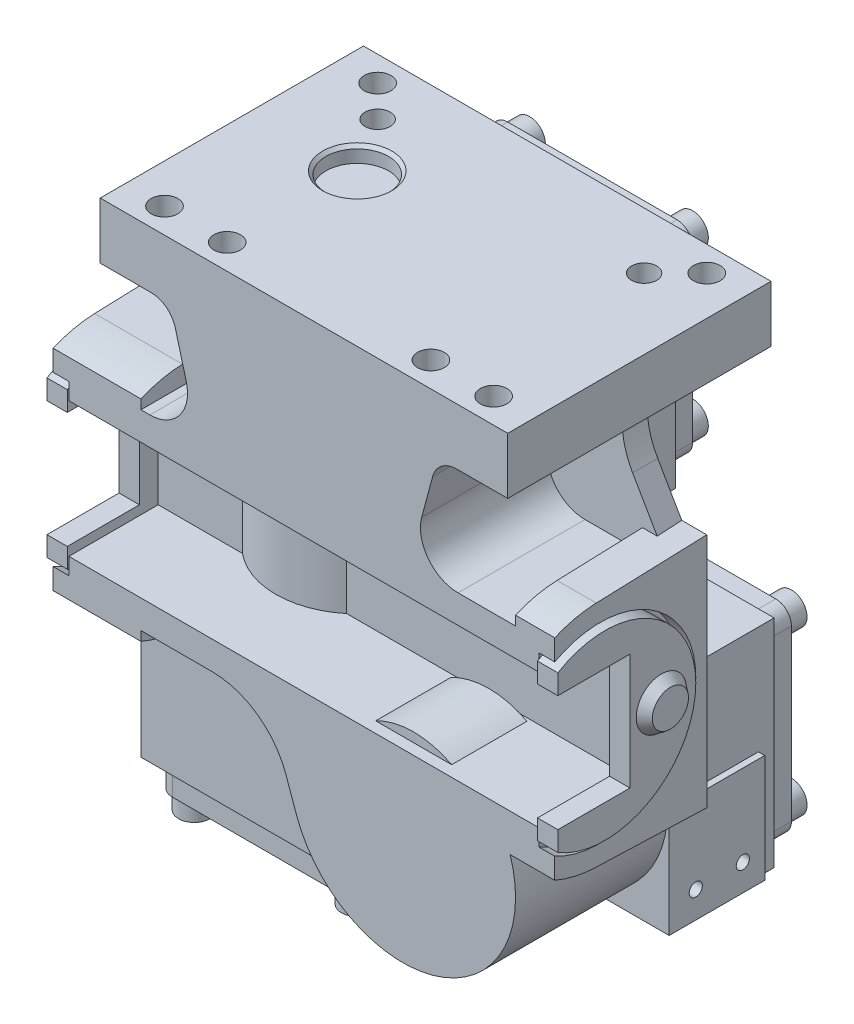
SolidWorks part; units mm, degrees
other "Detailelement1" parameters "D6"=21.1286, "D11"=12.0237, "D13"=58.5533, "D20"=12.7597, "D22"=117.4381, "Durchm_Senkung_Flansch__"=40, "D26"=74.2389, "D28"=10, "D15"=12.6748, "kopfduchm_zylsch_rolhaldeckel__"=10, "radius_rolhaldeckel__"=5, "D1"=72, "flanschbreite__"=84, "D2"=180, "D3"=63.247, "D4"=111.1593, "D5"=100.7124, "lochabstand_rolhaldeckel__"=52, "D7"=126.9513, "lochabstand_laengs_klein__"=20, "D8"=99.1768, "lochabstand_laengs_gross__"=65, "D9"=34.9237, "lochabstand_laengs_klein_2__"=20, "D10"=150, "lochabstand_breite__"=68, "D12"=55.5444, "D14"=57.5, "D16"=57.5, "D17"=52.75, "D18"=52.75, "D19"=52.75, "D21"=1.6078, "D23"=180, "laufposition_rolle_ort_AK_Schiene__"=7, "D24"=180, "Abstand_ort_rolle_bis_rolhaldeckel__"=68.5, "D25"=100.1259, "schienenbreite__"=29, "D27"=34.6, "flanschbreite_rolhaldeckel_lat_rolle__"=68, "breite_rippe_zwischen_ort_rollen__"=20, "breite_bearbeitete_flaeche_links__"=30.5, "dicke_rolhaldeckel__"=8, "kopfhoehe_zylsch_rolhaldeckel__"=6, "rollenbreite__"=24, "position_bearbeitete_flaeche_links__"=68, "rippenbreite__"=8
other "Detailelement2"
other "Detailelement3"
other "Detailelement4"
other "Detailelement5"
other "Detailelement6"
ref_plane "Ebene vorne" through (0, 0, 0) normal (0, 0, 1) x (1, 0, 0)
ref_plane "Ebene oben" through (0, 0, 0) normal (0, 1, 0) x (1, 0, 0)
ref_plane "Ebene rechts" through (0, 0, 0) normal (1, 0, 0) x (0, 0, -1)
sketch "Kontur_Aussenseite" plane through (0, 0, 0) normal (0, 0, 1) x (1, 0, 0)
  line L0 (-300, 0) -> (300, 0) construction
  line L1 (-300, 18.5) -> (300, 18.5) construction
  line L2 (-300, 18.5) -> (-300, -18.5) construction
  line L3 (-300, -18.5) -> (300, -18.5) construction
  line L4 (300, 18.5) -> (300, -18.5) construction
  line L5 (0, 0) -> (0, 44.5) construction
  line L6 (-34.5, 64.5) -> (-34.5, 49.5436)
  line L7 (-3, -79) -> (66, -79)
  line L8 (-3, -79) -> (-3, -49.5436)
  line L9 (-3, -10) -> (66, -10)
  line L10 (66, -79) -> (66, -10)
  line L11 (-3, -79) -> (66, -10) construction
  line L12 (-3, -10) -> (66, -79) construction
  line L13 (-34.5, 10) -> (34.5, 10)
  line L14 (34.5, 10) -> (34.5, 64.5)
  line L15 (34.5, 64.5) -> (65, 64.5)
  line L16 (65, 64.5) -> (65, 82.5)
  line L17 (65, 82.5) -> (-65, 82.5)
  line L18 (-65, 82.5) -> (-65, 64.5)
  line L19 (-65, 64.5) -> (-34.5, 64.5)
  line L20 (0, 44.5) -> (0, 82.5) construction
  line L21 (0, 44.5) -> (-31.25, 44.5) construction
  line L22 (31.5, -44.5) -> (0.25, -44.5) construction
  line L23 (-34.5, 39.4564) -> (-34.5, 10)
  line L24 (-3, -39.4564) -> (-3, -10)
  line L28 (-31.5, -83.9179) -> (-31.5, 0) construction
  line L29 (-66.5, -40) -> (4.5, -40)
  line L30 (-66.5, -40) -> (-66.5, -80)
  line L31 (-66.5, -80) -> (4.5, -80)
  line L32 (4.5, -40) -> (4.5, -80)
  line L33 (-57.5, -11.5) -> (-5.5, -11.5) construction
  line L34 (-57.5, 0.5) -> (-5.5, 0.5) construction
  line L35 (-57.5, 0.5) -> (-57.5, -23.5) construction
  line L36 (-57.5, -23.5) -> (-5.5, -23.5) construction
  line L37 (-5.5, 0.5) -> (-5.5, -23.5) construction
  line L41 (-65.5, -40) -> (-65.5, 18)
  line L42 (-65.5, 18) -> (2.5, 18)
  line L43 (2.5, 18) -> (2.5, -40)
  line L50 (-31.5, 0) -> (-31.5, 74) construction
  line L53 (26, 18.5) -> (34.5, 10) construction
  line L54 (-26, 18.5) -> (26, 18.5) construction
  line L55 (-26, 18.5) -> (-26, 70.5) construction
  line L56 (-26, 70.5) -> (26, 70.5) construction
  line L57 (26, 18.5) -> (26, 70.5) construction
  line L58 (-26, 18.5) -> (26, 70.5) construction
  line L59 (-26, 70.5) -> (26, 18.5) construction
  line L60 (5.5, -18.5) -> (57.5, -18.5) construction
  line L61 (5.5, -18.5) -> (5.5, -70.5) construction
  line L62 (5.5, -70.5) -> (57.5, -70.5) construction
  line L63 (57.5, -18.5) -> (57.5, -70.5) construction
  line L68 (-63.5, -80) -> (-63.5, -88)
  line L69 (-63.5, -88) -> (0.5, -88)
  line L74 (0.5, -88) -> (0.5, -80)
  line L75 (-62.5, -88) -> (-62.5, -94)
  line L76 (-62.5, -94) -> (-52.5, -94)
  line L77 (-52.5, -94) -> (-52.5, -88)
  line L78 (-10.5, -88) -> (-10.5, -94)
  line L79 (-10.5, -94) -> (-0.5, -94)
  line L80 (-0.5, -94) -> (-0.5, -88)
  line L81 (-57.5, -94) -> (-57.5, -88) construction
  line L82 (-5.5, -94) -> (-5.5, -88) construction
  line L83 (-57.5, -91) -> (-5.5, -91) construction
  line L85 (-27, 76.5) -> (27, 76.5)
  line L86 (-32, 71.5) -> (-32, 17.5)
  line L87 (-27, 12.5) -> (27, 12.5)
  line L88 (32, 71.5) -> (32, 17.5)
  line L89 (4.5, -12.5) -> (58.5, -12.5)
  line L90 (-0.5, -17.5) -> (-0.5, -71.5)
  line L91 (4.5, -76.5) -> (58.5, -76.5)
  line L92 (63.5, -17.5) -> (63.5, -71.5)
  circle A0 centre (0, 44.5) radius 26 construction
  circle A1 centre (31.5, -44.5) radius 26 construction
  arc A2 (-34.5, 49.5436) -> (-34.5, 39.4564) centre (-31.25, 44.5) ccw
  arc A3 (-3, -39.4564) -> (-3, -49.5436) centre (0.25, -44.5) ccw
  circle A4 centre (26, 70.5) radius 5
  circle A5 centre (-26, 70.5) radius 5
  circle A6 centre (-26, 18.5) radius 5
  circle A7 centre (26, 18.5) radius 5
  circle A8 centre (57.5, -18.5) radius 5
  circle A9 centre (5.5, -18.5) radius 5
  circle A10 centre (57.5, -70.5) radius 5
  circle A11 centre (5.5, -70.5) radius 5
  arc A12 (-27, 76.5) -> (-32, 71.5) centre (-27, 71.5) ccw
  arc A13 (27, 76.5) -> (32, 71.5) centre (27, 71.5) cw
  arc A14 (27, 12.5) -> (32, 17.5) centre (27, 17.5) ccw
  arc A15 (-32, 17.5) -> (-27, 12.5) centre (-27, 17.5) ccw
  arc A16 (4.5, -12.5) -> (-0.5, -17.5) centre (4.5, -17.5) ccw
  arc A17 (58.5, -12.5) -> (63.5, -17.5) centre (58.5, -17.5) cw
  arc A18 (58.5, -76.5) -> (63.5, -71.5) centre (58.5, -71.5) ccw
  arc A19 (-0.5, -71.5) -> (4.5, -76.5) centre (4.5, -71.5) ccw
  point P6 (0, 0)
  point P19 (0, 10)
  point P26 (0, 44.5)
  point P28 (31.5, -44.5)
  point P29 (-31.25, 44.5)
  point P30 (0.25, -44.5)
  point P52 (-31.5, -11.5)
  point P57 (-31.5, 0)
  point P68 (-31.5, -88)
  point P69 (0, 18.5)
  point P71 (31.5, -18.5)
  point P80 (5.5, -18.5)
  point P81 (57.5, -18.5)
  point P82 (57.5, -70.5)
  point P83 (5.5, -70.5)
  point P84 (-26, 70.5)
  point P85 (26, 70.5)
  point P86 (26, 18.5)
  point P87 (-26, 18.5)
  point P103 (-31.5, -91)
  point P104 (4.5, -80)
  point P105 (-66.5, -80)
  point P130 (57.5, -44.5)
  dimension "Rollendurchmesser_ort__" = 52
  dimension "Durchm_Gussausbuchtung_Sicherungsschraube__" = 12
  dimension "Zylsch_kopfdurchmesser_rolhaldeckel__" = 10
  dimension "Radius_rolhaldeckel__" = 5
  dimension "Schienenhoehe__" = 37
  dimension "D2" = 600
  dimension "Abstand_Ursprung_bis_ort_Rolle__" = 31.5
  dimension "flanschbreite_rolhaldeckel_ort_rolle__" = 69
  dimension "abstand_flansch_obereRolle__" = 38
  dimension "flanschdicke__" = 18
  dimension "l_flansch__" = 130
  dimension "Abstand_Sicherungsschraube_Exzenter__" = 31.25
  dimension "Abstand_Ursprung_bis_lat_Rolle__" = 31.5
  dimension "Rollendurchmesser_lat__" = 52
  dimension "Rollenbreite__" = 24
  dimension "Laufposition_lat_Rolle_UKSchiene__" = 7
  dimension "Abstand_lat_Rolle_rolhaldeckel__" = 68.5
  dimension "flanschdicke_lat_rolle__" = 40
  dimension "durchm_guss_lat_rolle__" = 68
  dimension "l_Gusszylinder_lat_Rolle__" = 98
  dimension "Lochabstand_rolhaldeckel__" = 52
  dimension "zentrum_lat_rolle_bis_flaeche_mitte__" = 36
  dimension "zentrum_lat_rolle_bis_flaeche_aussen__" = 35
  dimension "l_rolhaldeckel_lat__" = 64
  dimension "dicke_rolhaldeckel__" = 8
  dimension "kopfhoehe_zylsch_rolhaldeckel__" = 6
  dimension "zylschkopfduchrm_rolhaldeckel__" = 10
  dimension "l_rolhaldeckel__" = 64
sketch "Kontur_Innenseite" plane through (0, 0, 0) normal (0, 0, 1) x (1, 0, 0)
  line L0 (-300, -18.5) -> (300, -18.5) construction
  line L1 (-300, 18.5) -> (300, 18.5) construction
  line L2 (-300, -18.5) -> (300, -18.5) construction
  line L3 (-300, 18.5) -> (300, 18.5) construction
  line L4 (65, 64.5) -> (65, 82.5) construction
  line L5 (-65, 82.5) -> (-65, 64.5) construction
  line L6 (65, 82.5) -> (-65, 82.5) construction
  line L7 (65, 64.5) -> (65, 82.5)
  line L8 (-65, 82.5) -> (-65, 64.5)
  line L9 (65, 82.5) -> (-65, 82.5)
  line L10 (34.5, 64.5) -> (65, 64.5) construction
  line L11 (-65, 64.5) -> (-34.5, 64.5) construction
  line L12 (40, 64.5) -> (65, 64.5)
  line L13 (-65, 64.5) -> (-40, 64.5)
  line L16 (-300, 18.5) -> (-300, -18.5) construction
  line L17 (300, 18.5) -> (300, -18.5) construction
  line L18 (300, 0) -> (-300, 0) construction
  line L19 (67.5, 30.5) -> (67.5, 50)
  line L22 (24.7389, 82.5) -> (80.1583, -74.0818) construction
  line L23 (67.5, 30.5) -> (51.4563, 30.5)
  line L28 (-52, -30.5) -> (-29.3147, -30.5)
  line L29 (-5.7473, -47.1587) -> (-33.9371, 32.4886) construction
  line L30 (-5.7473, -47.1587) -> (-2.4371, -56.5114)
  line L40 (-61, 64.5) -> (-61, 63.5)
  line L41 (-64.3494, 51) -> (-64.9267, 50)
  line L42 (0, 82.5) -> (0, 0) construction
  line L44 (61, 64.5) -> (61, 63.5)
  line L45 (67.5, -30.5) -> (67.5, -50) construction
  line L46 (67.5, -50) -> (67.0774, -50) construction
  line L51 (-52, 30.5) -> (-52, -30.5) construction
  line L59 (67.5, 30.5) -> (67.5, -30.5) construction
  line L60 (-52, 30.5) -> (-76.185, 30.5) construction
  line L66 (-64.9267, 50) -> (-76.185, 30.5) construction
  line L68 (-80, -50) -> (-52, -50)
  line L69 (-52, -50) -> (-52, -30.5)
  line L70 (-52, 30.5) -> (-52, 50)
  line L71 (-52, 50) -> (-80, 50)
  line L72 (-80, 50) -> (-80, -50)
  line L74 (64.3494, 51) -> (67.5, 45.5429)
  line L75 (67.5, 50) -> (80, 50)
  line L77 (80, -50) -> (67.0774, -50)
  line L79 (80, 50) -> (80, -50)
  line L83 (-36, 59.98) -> (-36, 60.5)
  line L84 (-52, 30.5) -> (-51.4563, 30.5)
  line L86 (51.4563, 30.5) -> (67.5, 30.5)
  line L87 (-36, 52.4356) -> (-36, 44.5) construction
  line L88 (36, 60.5) -> (36, 59.98)
  line L89 (-36, 52.4356) -> (-36, 59.98) construction
  line L90 (36, 59.98) -> (36, 44.5) construction
  line L91 (67.5, 45.5429) -> (76.185, 30.5) construction
  line L92 (76.185, 30.5) -> (67.5, 30.5) construction
  circle A0 centre (31.5, -44.5) radius 26 construction
  circle A1 centre (0, 44.5) radius 26 construction
  circle A2 centre (31.5, -44.5) radius 26 construction
  circle A3 centre (0, 44.5) radius 26 construction
  arc A5 (-2.4371, -56.5114) -> (67.0774, -50) centre (31.5, -44.5) ccw
  arc A7 (36, 44.5) -> (-36, 44.5) centre (0, 44.5) cw construction
  arc A15 (-29.3147, -30.5) -> (-5.7473, -47.1587) centre (-29.3147, -55.5) cw
  arc A18 (51.4563, 30.5) -> (39.5818, 40.7692) centre (51.4563, 42.5) cw
  arc A20 (-61, 63.5) -> (-64.3494, 51) centre (-86, 63.5) cw
  arc A21 (61, 63.5) -> (64.3494, 51) centre (86, 63.5) ccw
  arc A24 (-40, 64.5) -> (-36, 60.5) centre (-40, 60.5) cw
  arc A30 (-51.4563, 30.5) -> (-39.5818, 40.7692) centre (-51.4563, 42.5) ccw
  arc A31 (-39.5818, 40.7692) -> (-38, 47.49) centre (0, 35) cw
  arc A32 (39.5818, 40.7692) -> (51.4563, 30.5) centre (51.4563, 42.5) ccw
  arc A33 (-38, 47.49) -> (-36, 59.98) centre (-76, 59.98) ccw
  arc A36 (36, 60.5) -> (40, 64.5) centre (40, 60.5) cw
  arc A39 (38, 47.49) -> (36, 59.98) centre (76, 59.98) cw
  arc A40 (39.5818, 40.7692) -> (38, 47.49) centre (0, 35) ccw
  point P7 (-80, 0)
  point P21 (-76.185, 30.5)
  point P51 (-52, 0)
  point P103 (-67.5, 25)
  dimension "Radius_unten__" = 25
  dimension "D9" = 100
  dimension "Radius_an_rippe__" = 25
  dimension "erster_Radius_oben__" = 4
  dimension "Gussradius_ort_rollen__" = 36
  dimension "zweiter_Radius_oben__" = 40
  dimension "dritter_Radius_oben__" = 40
  dimension "vierter_Radius_oben__" = 12
  dimension "offset_Rippe__" = 4
  dimension "lanege_gerades_stueck_rippe__" = 1
  dimension "winkel_rippe__" = 30
  dimension "hor_position_schmiergewinde__" = 12.5
  dimension "ver_position_schmiergewinde__" = 25
  dimension "Zentrum_bis_linkes_ende__" = 80
  dimension "Zentrum_bis_rechtes_ende__" = 80
  dimension "zentrum_dritter_radius__" = 35
  dimension "Gussbahnbreite_aussen__" = 61
  dimension "abstreiferflanschbreite_links__" = 28
  dimension "abstreiferflanschbreite_rechts__" = 12.5
sketch "Grundriss" plane through (0, 0, 0) normal (0, 1, 0) x (1, 0, 0)
  line L1 (65, -42) -> (-65, -42)
  line L2 (65, -42) -> (65, 42)
  line L3 (65, 42) -> (-65, 42)
  line L4 (-65, -42) -> (-65, 42)
  line L5 (65, -42) -> (-65, 42) construction
  line L6 (65, 42) -> (-65, -42) construction
  line L8 (-66.5, 40.5) -> (-66.5, -27.5)
  line L9 (-57.5, 6.5) -> (-66.5, 6.5) construction
  line L10 (-65.5, 0) -> (-65.5, 6.5) construction
  line L11 (-300, 0) -> (300, 0) construction
  line L12 (0, 6.5) -> (0, 0) construction
  line L19 (4.5, 40.5) -> (4.5, -27.5)
  line L20 (-5.5, -19.5) -> (-57.5, -19.5) construction
  line L21 (-5.5, -19.5) -> (-5.5, 32.5) construction
  line L22 (-5.5, 32.5) -> (-57.5, 32.5) construction
  line L23 (-57.5, -19.5) -> (-57.5, 32.5) construction
  line L25 (-5.5, 32.5) -> (-57.5, -19.5) construction
  line L26 (-31.5, 6.5) -> (-57.5, 6.5) construction
  line L27 (-31.5, 26.5) -> (34.5, 26.5)
  line L28 (-31.5, 6.5) -> (-31.5, 32.5) construction
  line L31 (0, 0) -> (52.5, 0) construction
  line L32 (-52.5, 34) -> (52.5, 34) construction
  line L33 (-52.5, 34) -> (-52.5, -34) construction
  line L34 (-52.5, -34) -> (52.5, -34) construction
  line L35 (52.5, 34) -> (52.5, -34) construction
  line L36 (0, 34) -> (0, 0) construction
  line L37 (34.5, 26.5) -> (34.5, 0)
  line L38 (5.5, 0) -> (57.5, 0) construction
  line L39 (65, 37) -> (68, 37)
  line L40 (68, 37) -> (68, 0)
  line L41 (-3, 0) -> (66, 0) construction
  line L42 (65, 42) -> (63.5, 42) construction
  line L47 (-300, -26.5) -> (300, -26.5) construction
  line L48 (-300, -19.5) -> (300, -19.5) construction
  line L49 (-300, -19.5) -> (-300, -48.5) construction
  line L50 (-300, -48.5) -> (300, -48.5) construction
  line L51 (300, -19.5) -> (300, -48.5) construction
  line L52 (-57.5, 0) -> (-57.5, 6.5) construction
  line L53 (-31.5, 0) -> (-31.5, 6.5) construction
  line L55 (-66.5, 40.5) -> (4.5, 40.5)
  line L58 (4.5, -27.5) -> (-66.5, -27.5)
  line L59 (63.5, 42) -> (63.5, 50)
  line L61 (63.5, 50) -> (-0.5, 50)
  line L62 (-0.5, 50) -> (-0.5, 42)
  line L63 (0.5, 50) -> (0.5, 56)
  line L64 (0.5, 56) -> (10.5, 56)
  line L66 (10.5, 56) -> (10.5, 50)
  line L67 (-10.5, 0) -> (-0.5, 0) construction
  line L68 (5.5, 56) -> (5.5, 50) construction
  line L69 (31.5, 50) -> (31.5, -26.5) construction
  line L70 (-58.5, 38.5) -> (-4.5, 38.5)
  line L71 (-63.5, 33.5) -> (-63.5, -20.5)
  line L72 (-58.5, -25.5) -> (-4.5, -25.5)
  line L73 (0.5, 33.5) -> (0.5, -20.5)
  line L74 (-63.5, 6.5) -> (-76.185, 6.5) construction
  line L75 (5.5, -38.5) -> (57.5, -38.5) construction
  line L76 (5.5, -38.5) -> (5.5, -14.5) construction
  line L77 (5.5, -14.5) -> (57.5, -14.5) construction
  line L78 (57.5, -38.5) -> (57.5, -14.5) construction
  line L79 (5.5, -38.5) -> (57.5, -14.5) construction
  line L80 (5.5, -14.5) -> (57.5, -38.5) construction
  line L81 (-76.185, 6.5) -> (-76.185, -1.5) construction
  line L82 (-76.185, -1.5) -> (-65, -1.5) construction
  circle A2 centre (-31.5, 6.5) radius 34
  circle A10 centre (-57.5, 32.5) radius 5
  circle A14 centre (-57.5, -19.5) radius 5
  circle A22 centre (-31.5, 6.5) radius 26 construction
  circle A25 centre (-5.5, 32.5) radius 5
  circle A26 centre (-5.5, -19.5) radius 5
  arc A27 (-58.5, 38.5) -> (-63.5, 33.5) centre (-58.5, 33.5) ccw
  arc A28 (-4.5, 38.5) -> (0.5, 33.5) centre (-4.5, 33.5) cw
  arc A29 (-4.5, -25.5) -> (0.5, -20.5) centre (-4.5, -20.5) ccw
  arc A30 (-63.5, -20.5) -> (-58.5, -25.5) centre (-58.5, -20.5) ccw
  circle A31 centre (-31.5, 6.5) radius 10 construction
  point P0 (0, 0)
  point P7 (0, -48.5)
  point P8 (0, 6.5)
  point P22 (0, -19.5)
  point P29 (34.5, 0)
  point P30 (0, 42)
  point P33 (0, -42)
  point P38 (-57.5, 32.5)
  point P39 (-5.5, 32.5)
  point P40 (-5.5, -19.5)
  point P41 (-57.5, -19.5)
  point P59 (32.5, -34)
  point P60 (-32.5, -34)
  point P61 (-52.5, -34)
  point P62 (52.5, -34)
  point P63 (52.5, 34)
  point P64 (-52.5, 34)
  point P108 (-63.5, 6.5)
sketch "Seitenriss" plane through (0, 0, 0) normal (1, 0, 0) x (0, 0, -1)
  line L0 (0, 0) -> (-48.5, 0) construction
  line L1 (34, 0) -> (-34, 0) construction
  line L2 (-48.5, 18.5) -> (-19.5, 18.5) construction
  line L3 (-48.5, 18.5) -> (-48.5, -18.5) construction
  line L4 (-48.5, -18.5) -> (-19.5, -18.5) construction
  line L5 (-19.5, 18.5) -> (-19.5, -18.5) construction
  line L6 (6.5, -79) -> (37, -79)
  line L7 (15, -70.5) -> (30, -70.5) construction
  line L9 (-42.5, 26.5565) -> (-42.5, 18.5)
  line L10 (37, -79) -> (37, -44.5)
  line L12 (37, -44.5) -> (6.5, -44.5)
  line L13 (6.5, -44.5) -> (6.5, -79)
  line L26 (-42.5, -18.5) -> (-42.5, -26.5565)
  line L39 (-42, 21.5) -> (-42, -21.5) construction
  line L40 (-42, 21.5) -> (-13.5, 21.5)
  line L41 (-13.5, 21.5) -> (-13.5, -21.5)
  line L42 (-13.5, -21.5) -> (-42, -21.5)
  line L44 (-42, 33.4963) -> (-42, 21.5)
  line L46 (-42, -33.4963) -> (-42, -21.5)
  line L48 (6.5, -37.7096) -> (-28.7738, -36.4778)
  line L49 (6.5, 37.7096) -> (-28.7738, 36.4778)
  line L52 (6.5, 37.7096) -> (6.5, -37.7096)
  line L56 (-15.7181, -41.6798) -> (-38.043, -34.9442) construction
  line L57 (-13.75, -42.0055) -> (6.5, -42.7126) construction
  line L58 (6.5, -37.7096) -> (6.5, -42.7126) construction
  line L59 (-38.5, 18.5) -> (-38.5, 70.5) construction
  line L60 (-38.5, 70.5) -> (-14.5, 70.5) construction
  line L61 (-14.5, 70.5) -> (-14.5, 18.5) construction
  line L62 (-14.5, 18.5) -> (-19.5, 18.5) construction
  line L63 (-26.5, 70.5) -> (-26.5, 18.5) construction
  line L64 (-38.5, 44.5) -> (-14.5, 44.5) construction
  line L65 (-38.5, -18.5) -> (-38.5, -70.5) construction
  line L66 (-38.5, -70.5) -> (-14.5, -70.5) construction
  line L67 (-14.5, -70.5) -> (-14.5, -18.5) construction
  line L68 (-14.5, -18.5) -> (-19.5, -18.5) construction
  line L69 (-38.5, -44.5) -> (-14.5, -44.5) construction
  line L70 (-26.5, -70.5) -> (-26.5, -18.5) construction
  arc A1 (-28.7738, 36.4778) -> (-42, 33.4963) centre (-27.5, 0) ccw
  arc A2 (-42.5, -26.5565) -> (-42.5, 26.5565) centre (-27.5, 0) ccw
  arc A3 (-42, -33.4963) -> (-28.7738, -36.4778) centre (-27.5, 0) ccw
  arc A4 (-13.75, -42.0055) -> (-15.7181, -41.6798) centre (-13.4795, -34.2602) cw construction
  arc A5 (-42.5, -24.8193) -> (-42.5, 24.8193) centre (-27.5, 0) ccw
  point P7 (-48.5, 0)
  point P16 (15, -70.5)
  point P17 (30, -70.5)
  point P50 (-42, 0)
  point P51 (-9.5, 0)
  dimension "Aussendurchm_Abstreiferflansch__" = 73
  dimension "durchm_abstreiferanfraesung__" = 61
  dimension "D1" = 15
  dimension "D5" = 7.75
  dimension "D6" = 1.5
  dimension "D3" = 20.25
  dimension "D4" = 5
  dimension "abstand_schiene_bis_Guss__" = 6
  dimension "D21" = 4
  dimension "D22" = 2
  dimension "Nuthoehe_Schiene__" = 43
  dimension "pos_befestigungsloch_abstreifer__" = 9.5
  dimension "pos_zentrum_abstreifer__" = 27.5
  dimension "hor_pos_gewinde_nulmar__" = 15
  dimension "hor_abstand_gewinde_nulmar__" = 15
  dimension "ver_pos_gewinde_nulmar__" = 70.5
ref_plane "Ebene4" through (0, 0, -6.5) normal (0, 0, 1) x (1, 0, 0)
sketch "Skizze4" plane through (0, 0, -6.5) normal (0, 0, 1) x (1, 0, 0)
  line L0 (-65, 64.5) -> (-34.5, 64.5) construction
  line L1 (-34.5, 64.5) -> (-34.5, 49.5436) construction
  line L2 (-34.5, 39.4564) -> (-34.5, 10) construction
  line L3 (-34.5, 10) -> (34.5, 10) construction
  line L4 (34.5, 10) -> (34.5, 64.5) construction
  line L5 (34.5, 64.5) -> (65, 64.5) construction
  line L6 (-65, 82.5) -> (-65, 64.5) construction
  line L8 (65, 64.5) -> (65, 82.5) construction
  line L11 (-65, 64.5) -> (-34.5, 64.5)
  line L12 (-34.5, 64.5) -> (-34.5, 49.5436)
  line L13 (-34.5, 39.4564) -> (-34.5, 10)
  line L14 (-34.5, 10) -> (34.5, 10)
  line L15 (34.5, 10) -> (34.5, 64.5)
  line L16 (34.5, 64.5) -> (65, 64.5)
  line L17 (-65, 82.5) -> (-65, 64.5)
  line L18 (65, 82.5) -> (-65, 82.5) construction
  line L19 (65, 64.5) -> (65, 82.5)
  line L20 (65, 82.5) -> (-65, 82.5)
  line L22 (66, -79) -> (66, -10) construction
  line L23 (-3, -79) -> (66, -79) construction
  line L24 (-3, -79) -> (-3, -49.5436) construction
  line L25 (-3, -39.4564) -> (-3, -10) construction
  line L26 (-3, -10) -> (66, -10) construction
  line L27 (66, -79) -> (66, -10)
  line L28 (-3, -79) -> (66, -79)
  line L29 (-3, -79) -> (-3, -49.5436)
  line L30 (-3, -39.4564) -> (-3, -10)
  line L31 (-3, -10) -> (66, -10)
  arc A0 (-34.5, 49.5436) -> (-34.5, 39.4564) centre (-31.25, 44.5) ccw construction
  arc A1 (-34.5, 49.5436) -> (-34.5, 39.4564) centre (-31.25, 44.5) ccw
  arc A2 (-3, -39.4564) -> (-3, -49.5436) centre (0.25, -44.5) ccw construction
  arc A3 (-3, -39.4564) -> (-3, -49.5436) centre (0.25, -44.5) ccw
extrude "Linear austragen1" add sketch "Skizze4" against normal up to vertex (35.5 mm away)
sketch "Skizze9" plane through (0, 0, -6.5) normal (0, 0, 1) x (1, 0, 0)
  line L0 (34.5, 10) -> (34.5, 64.5) construction
  line L1 (34.5, 10) -> (34.5, -10)
  line L2 (66, -10) -> (-3, -10) construction
  line L3 (34.5, -10) -> (-3, -10)
  line L4 (-34.5, 10) -> (34.5, 10) construction
  line L5 (-31.5, 10) -> (34.5, 10)
  line L6 (-3, -10) -> (-3, -39.4564) construction
  line L7 (-3, -10) -> (-3, -79)
  line L8 (-31.5, 10) -> (-31.5, -79)
  line L9 (-31.5, -79) -> (-3, -79)
  line L10 (-31.5, -83.9179) -> (-31.5, 0) construction
extrude "Linear austragen4" add sketch "Skizze9" against normal up to vertex (20 mm away)
sketch "Skizze7" [suppressed] plane through (0, 0, -1.25) normal (0, 0, 1) x (1, 0, 0)
  line L1 (90, 104.3) -> (90, 131.3) construction
  line L2 (69, 104.3) -> (90, 104.3) construction
  line L3 (90, 131.3) -> (-90, 131.3) construction
  line L4 (100, 37) -> (88.3375, 37) construction
  line L5 (-59, 86.815) -> (-59, 94.3) construction
  line L6 (-59, 86.815) -> (-59, 94.3)
  line L7 (-90.5, 37) -> (-88.3375, 37) construction
  line L8 (-90.5, 37) -> (-88.3375, 37)
  line L10 (-11.1537, -69.3613) -> (-3.7068, -89.1137) construction
  line L11 (-90.5, -37) -> (-57.9391, -37) construction
  line L12 (59, 94.3) -> (59, 86.815) construction
  line L13 (59, 94.3) -> (59, 86.815)
  line L14 (100, 37) -> (100, -37) construction
  line L15 (90, 131.3) -> (-90, 131.3)
  line L16 (-90, 104.3) -> (-69, 104.3) construction
  line L17 (-90, 131.3) -> (-90, 104.3) construction
  line L21 (90, 104.3) -> (90, 131.3)
  line L22 (69, 104.3) -> (90, 104.3)
  line L23 (100, 37) -> (100, -34.7031)
  line L24 (100, 37) -> (88.3375, 37)
  line L30 (-11.1537, -69.3613) -> (-3.7068, -89.1137)
  line L31 (-90.5, -37) -> (-57.9391, -37)
  line L36 (-90, 104.3) -> (-69, 104.3)
  line L37 (-90, 131.3) -> (-90, 104.3)
  line L41 (-90.5, 37) -> (-90.5, -37) construction
  line L42 (-90.5, 37) -> (-90.5, -37)
  arc A2 (72.0142, 49.2511) -> (88.3375, 37) centre (88.3375, 54) ccw construction
  arc A3 (-3.7068, -89.1137) -> (107.5902, -50) centre (51.5, -68.3) ccw construction
  arc A4 (-11.1537, -69.3613) -> (-57.9391, -37) centre (-57.9391, -87) ccw construction
  arc A8 (69, 104.3) -> (59, 94.3) centre (69, 94.3) ccw construction
  arc A9 (59, 86.815) -> (64.5652, 66.4619) centre (99, 86.815) ccw construction
  arc A10 (72.0142, 49.2511) -> (88.3375, 37) centre (88.3375, 54) ccw
  arc A11 (-3.7068, -89.1137) -> (100, -34.7031) centre (51.5, -68.3) ccw
  arc A12 (-11.1537, -69.3613) -> (-57.9391, -37) centre (-57.9391, -87) ccw
  arc A14 (-88.3375, 37) -> (-72.0142, 49.2511) centre (-88.3375, 54) ccw construction
  arc A16 (-59, 94.3) -> (-69, 104.3) centre (-69, 94.3) ccw construction
  arc A17 (-88.3375, 37) -> (-72.0142, 49.2511) centre (-88.3375, 54) ccw
  arc A18 (-59, 94.3) -> (-69, 104.3) centre (-69, 94.3) ccw
  arc A19 (-64.5652, 66.4619) -> (-59, 86.815) centre (-99, 86.815) ccw construction
  arc A20 (-64.5652, 66.4619) -> (-72.0142, 49.2511) centre (0, 28.3) ccw construction
  arc A21 (-64.5652, 66.4619) -> (-59, 86.815) centre (-99, 86.815) ccw
  arc A22 (-64.5652, 66.4619) -> (-72.0142, 49.2511) centre (0, 28.3) ccw
  arc A23 (72.0142, 49.2511) -> (64.5652, 66.4619) centre (0, 28.3) ccw construction
  arc A24 (69, 104.3) -> (59, 94.3) centre (69, 94.3) ccw
  arc A25 (59, 86.815) -> (64.5652, 66.4619) centre (99, 86.815) ccw
  arc A26 (72.0142, 49.2511) -> (64.5652, 66.4619) centre (0, 28.3) ccw
extrude "Kontur_Schienenseitig_RB72_90" [suppressed] add sketch "Skizze7" along normal up to vertex
sketch "Skizze91" plane through (0, 0, -6.5) normal (0, 0, 1) x (1, 0, 0)
  line L0 (65, 64.5) -> (65, 82.5) construction
  line L1 (-65, 82.5) -> (-65, 64.5) construction
  line L2 (65, 82.5) -> (-65, 82.5) construction
  line L3 (65, 64.5) -> (65, 82.5)
  line L4 (-65, 82.5) -> (-65, 64.5)
  line L5 (65, 82.5) -> (-65, 82.5)
  line L6 (-65, 64.5) -> (-34.5, 64.5) construction
  line L7 (-65, 64.5) -> (-48.7675, 64.5)
  line L8 (34.5, 64.5) -> (65, 64.5) construction
  line L9 (48.7675, 64.5) -> (65, 64.5)
  line L10 (67.5, -30.5) -> (67.5, -50) construction
  line L12 (-52, -30.5) -> (-29.3147, -30.5) construction
  line L13 (-52, 30.5) -> (-52, -30.5) construction
  line L14 (67.5, 30.5) -> (67.5, -30.5)
  line L16 (-52, -30.5) -> (-29.3147, -30.5)
  line L17 (-52, 30.5) -> (-52, -30.5)
  line L18 (-52, 30.5) -> (-51.4563, 30.5) construction
  line L19 (67.5, 30.5) -> (51.4563, 30.5) construction
  line L20 (-52, 30.5) -> (-49.1574, 30.5)
  line L21 (67.5, 30.5) -> (49.1574, 30.5)
  line L22 (-5.7473, -47.1587) -> (-2.4371, -56.5114) construction
  line L23 (-5.7473, -47.1587) -> (-2.4371, -56.5114)
  line L24 (-37.5662, 45.6058) -> (-41.0401, 58.5706)
  line L25 (67.5, -30.5) -> (64.6662, -30.5)
  line L26 (0, 82.5) -> (0, 0) construction
  line L27 (0, 82.5) -> (0, 0) construction
  line L29 (-37.5662, 45.6058) -> (-34.7733, 35.1825) construction
  line L30 (34.7733, 35.1825) -> (37.5662, 45.6058) construction
  line L31 (37.5662, 45.6058) -> (41.0401, 58.5706)
  arc A0 (-2.4371, -56.5114) -> (67.0774, -50) centre (31.5, -44.5) ccw construction
  arc A1 (-5.7473, -47.1587) -> (-29.3147, -30.5) centre (-29.3147, -55.5) ccw construction
  arc A2 (-2.4371, -56.5114) -> (64.6662, -30.5) centre (31.5, -44.5) ccw
  arc A3 (-5.7473, -47.1587) -> (-29.3147, -30.5) centre (-29.3147, -55.5) ccw
  arc A4 (-41.0401, 58.5706) -> (-48.7675, 64.5) centre (-48.7675, 56.5) ccw
  arc A5 (-49.1574, 30.5) -> (-37.5662, 45.6058) centre (-49.1574, 42.5) ccw
  arc A8 (-36, 44.5) -> (36, 44.5) centre (0, 44.5) ccw construction
  arc A9 (37.5662, 45.6058) -> (49.1574, 30.5) centre (49.1574, 42.5) ccw
  arc A10 (41.0401, 58.5706) -> (48.7675, 64.5) centre (48.7675, 56.5) cw
  dimension "D1" = 8
  dimension "D2" = 12
  dimension "D5" = 8
  dimension "D3" = 75
  dimension "D4" = 75
extrude "Kontur_Schienenseitig_RB40_52" add sketch "Skizze91" along normal up to vertex (48.5 mm away)
sketch "Skizze8" plane through (0, 0, -6.5) normal (0, 0, 1) x (1, 0, 0)
  line L0 (-52, 30.5) -> (-76.185, 30.5) construction
  line L1 (67.5, 30.5) -> (51.4563, 30.5) construction
  line L3 (61, 64.5) -> (61, 63.5) construction
  line L4 (40, 64.5) -> (65, 64.5) construction
  line L5 (36, 60.5) -> (36, 59.98) construction
  line L6 (76.185, 30.5) -> (51.4563, 30.5)
  line L7 (67.5, 45.5429) -> (76.185, 30.5) construction
  line L8 (61, 64.5) -> (61, 63.5)
  line L9 (40, 64.5) -> (61, 64.5)
  line L10 (-64.9267, 50) -> (-76.185, 30.5) construction
  line L11 (-64.3494, 51) -> (-64.9267, 50) construction
  line L12 (-61, 64.5) -> (-61, 63.5) construction
  line L13 (-65, 64.5) -> (-40, 64.5) construction
  line L14 (-52, 30.5) -> (-51.4563, 30.5) construction
  line L15 (-64.3494, 51) -> (-64.9267, 50)
  line L16 (-61, 64.5) -> (-61, 63.5)
  line L17 (-61, 64.5) -> (-40, 64.5)
  line L18 (-36, 59.98) -> (-36, 60.5) construction
  line L19 (-36, 59.98) -> (-36, 60.5)
  line L21 (-52, 30.5) -> (-51.4563, 30.5)
  line L22 (-52, 30.5) -> (-76.185, 30.5)
  line L23 (36, 60.5) -> (36, 59.98)
  line L24 (-64.9267, 50) -> (-76.185, 30.5)
  line L25 (67.5, 45.5429) -> (76.185, 30.5)
  line L26 (64.3494, 51) -> (67.5, 45.5429) construction
  line L27 (64.3494, 51) -> (67.5, 45.5429)
  arc A1 (39.5818, 40.7692) -> (51.4563, 30.5) centre (51.4563, 42.5) ccw construction
  arc A2 (61, 63.5) -> (64.3494, 51) centre (86, 63.5) ccw construction
  arc A4 (40, 64.5) -> (36, 60.5) centre (40, 60.5) ccw construction
  arc A5 (39.5818, 40.7692) -> (51.4563, 30.5) centre (51.4563, 42.5) ccw
  arc A6 (61, 63.5) -> (64.3494, 51) centre (86, 63.5) ccw
  arc A7 (36, 59.98) -> (38, 47.49) centre (76, 59.98) ccw construction
  arc A10 (-64.3494, 51) -> (-61, 63.5) centre (-86, 63.5) ccw construction
  arc A12 (-38, 47.49) -> (-36, 59.98) centre (-76, 59.98) ccw construction
  arc A13 (-38, 47.49) -> (-39.5818, 40.7692) centre (0, 35) ccw construction
  arc A14 (-64.3494, 51) -> (-61, 63.5) centre (-86, 63.5) ccw
  arc A15 (-36, 60.5) -> (-40, 64.5) centre (-40, 60.5) ccw construction
  arc A17 (-36, 60.5) -> (-40, 64.5) centre (-40, 60.5) ccw
  arc A18 (-51.4563, 30.5) -> (-39.5818, 40.7692) centre (-51.4563, 42.5) ccw construction
  arc A19 (-38, 47.49) -> (-36, 59.98) centre (-76, 59.98) ccw
  arc A20 (-38, 47.49) -> (-39.5818, 40.7692) centre (0, 35) ccw
  arc A21 (-51.4563, 30.5) -> (-39.5818, 40.7692) centre (-51.4563, 42.5) ccw
  arc A22 (39.5818, 40.7692) -> (38, 47.49) centre (0, 35) ccw construction
  arc A23 (39.5818, 40.7692) -> (38, 47.49) centre (0, 35) ccw
  arc A24 (36, 59.98) -> (38, 47.49) centre (76, 59.98) ccw
  arc A25 (40, 64.5) -> (36, 60.5) centre (40, 60.5) ccw
extrude "Rippe_RB72_90" [suppressed] add sketch "Skizze8" along normal up to vertex contours L21 A21 A20 A19 A17 L17 L16 A14 L15 L24 L22 | L9 A25 A24 A23 A5 L6 L25 L27 A6 L8
sketch "Skizze92" plane through (0, 0, -6.5) normal (0, 0, 1) x (1, 0, 0)
  line L0 (-61, 64.5) -> (-61, 63.5) construction
  line L1 (-64.3494, 51) -> (-64.9267, 50) construction
  line L2 (-64.9267, 50) -> (-76.185, 30.5) construction
  line L3 (-52, 30.5) -> (-76.185, 30.5) construction
  line L4 (-52, 30.5) -> (-49.1574, 30.5) construction
  line L5 (-37.5662, 45.6058) -> (-41.0401, 58.5706) construction
  line L6 (-65, 64.5) -> (-48.7675, 64.5) construction
  line L7 (-61, 64.5) -> (-61, 63.5)
  line L8 (-64.3494, 51) -> (-64.9267, 50)
  line L9 (-64.9267, 50) -> (-76.185, 30.5)
  line L10 (-52, 30.5) -> (-76.185, 30.5)
  line L11 (-52, 30.5) -> (-49.1574, 30.5)
  line L12 (-37.5662, 45.6058) -> (-41.0401, 58.5706)
  line L13 (-61, 64.5) -> (-48.7675, 64.5)
  line L14 (61, 64.5) -> (61, 63.5) construction
  line L15 (48.7675, 64.5) -> (65, 64.5) construction
  line L16 (37.5662, 45.6058) -> (41.0401, 58.5706) construction
  line L17 (67.5, 30.5) -> (49.1574, 30.5) construction
  line L18 (64.3494, 51) -> (67.5, 45.5429) construction
  line L19 (67.5, 45.5429) -> (76.185, 30.5) construction
  line L20 (76.185, 30.5) -> (67.5, 30.5) construction
  line L21 (61, 64.5) -> (61, 63.5)
  line L22 (48.7675, 64.5) -> (61, 64.5)
  line L23 (37.5662, 45.6058) -> (41.0401, 58.5706)
  line L24 (67.5, 30.5) -> (49.1574, 30.5)
  line L25 (64.3494, 51) -> (67.5, 45.5429)
  line L26 (67.5, 45.5429) -> (76.185, 30.5)
  line L27 (76.185, 30.5) -> (67.5, 30.5)
  arc A0 (-64.3494, 51) -> (-61, 63.5) centre (-86, 63.5) ccw construction
  arc A1 (-49.1574, 30.5) -> (-37.5662, 45.6058) centre (-49.1574, 42.5) ccw construction
  arc A2 (-41.0401, 58.5706) -> (-48.7675, 64.5) centre (-48.7675, 56.5) ccw construction
  arc A3 (-64.3494, 51) -> (-61, 63.5) centre (-86, 63.5) ccw
  arc A4 (-49.1574, 30.5) -> (-37.5662, 45.6058) centre (-49.1574, 42.5) ccw
  arc A5 (-41.0401, 58.5706) -> (-48.7675, 64.5) centre (-48.7675, 56.5) ccw
  arc A6 (61, 63.5) -> (64.3494, 51) centre (86, 63.5) ccw construction
  arc A7 (48.7675, 64.5) -> (41.0401, 58.5706) centre (48.7675, 56.5) ccw construction
  arc A8 (37.5662, 45.6058) -> (49.1574, 30.5) centre (49.1574, 42.5) ccw construction
  arc A9 (61, 63.5) -> (64.3494, 51) centre (86, 63.5) ccw
  arc A10 (48.7675, 64.5) -> (41.0401, 58.5706) centre (48.7675, 56.5) ccw
  arc A11 (37.5662, 45.6058) -> (49.1574, 30.5) centre (49.1574, 42.5) ccw
extrude "Rippe_RB40_52" add sketch "Skizze92" along normal up to vertex (8 mm away)
ref_plane "Ebene1" through (0, -80, 0) normal (0, 1, 0) x (-1, 0, 0)
sketch "Skizze10" plane through (0, -80, 0) normal (0, 1, 0) x (-1, 0, 0)
  line L0 (-4.5, -40.5) -> (-4.5, 27.5) construction
  line L1 (-4.5, -40.5) -> (-4.5, 27.5)
  line L2 (66.5, -40.5) -> (66.5, 27.5) construction
  line L3 (66.5, -40.5) -> (66.5, 27.5)
  line L8 (-4.5, 27.5) -> (66.5, 27.5) construction
  line L10 (66.5, -40.5) -> (-4.5, -40.5) construction
  line L14 (-4.5, 27.5) -> (66.5, 27.5)
  line L16 (66.5, -40.5) -> (-4.5, -40.5)
extrude "Linear austragen5" add sketch "Skizze10" along normal up to vertex (40 mm away)
sketch "Skizze102" [suppressed] plane through (0, 0, -6.75) normal (0, 0, 1) x (1, 0, 0)
  line L0 (-26, -67.5) -> (18.3189, -67.5) construction
  line L5 (5, -65.5) -> (-26, -65.5)
  line L6 (-26, -65.5) -> (-26, -67.5)
  line L7 (-26, -67.5) -> (18.3189, -67.5)
  line L8 (5, -59.9243) -> (5, -65.5)
  line L9 (5, -65.5) -> (-26, -65.5)
  line L10 (-26, -65.5) -> (-26, -67.5)
  line L11 (-26, -67.5) -> (5, -67.5)
  line L12 (5, -67.5) -> (5, -65.5)
  arc A1 (5, -59.9243) -> (18.3189, -67.5) centre (26, -38.5) ccw
  dimension "D1" = 0
extrude "Schnitt-Linear austragen_RB40" [suppressed] cut sketch "Skizze102" against normal through all
sketch "Skizze11" plane through (0, -80, 0) normal (0, 1, 0) x (-1, 0, 0)
  circle A1 centre (31.5, -6.5) radius 34 construction
  circle A2 centre (31.5, -6.5) radius 34
extrude "Linear austragen6" add sketch "Skizze11" along normal up to vertex (98 mm away)
ref_plane "Ebene6" through (-80, 0, 0) normal (1, 0, 0) x (0, 0, -1)
ref_plane "Ebene7" through (80, 0, 0) normal (1, 0, 0) x (0, 0, -1)
sketch "Skizze13" plane through (-80, 0, 0) normal (-1, 0, 0) x (0, 0, 1)
  line L0 (-6.5, -37.7096) -> (28.7738, -36.4778) construction
  line L2 (-6.5, 37.7096) -> (28.7738, 36.4778) construction
  line L3 (-6.5, -37.7096) -> (28.7738, -36.4778)
  line L4 (-6.5, 37.7096) -> (-6.5, -37.7096) construction
  line L5 (-6.5, 37.7096) -> (28.7738, 36.4778)
  line L7 (42, 33.4963) -> (42, 21.5) construction
  line L9 (42, 33.4963) -> (42, -33.4963)
  line L10 (-6.5, 37.7096) -> (-6.5, -37.7096)
  arc A1 (28.7738, -36.4778) -> (42, -33.4963) centre (27.5, 0) ccw construction
  arc A2 (42, 33.4963) -> (28.7738, 36.4778) centre (27.5, 0) ccw
  arc A3 (28.7738, -36.4778) -> (42, -33.4963) centre (27.5, 0) ccw
extrude "Linear austragen7" add sketch "Skizze13" against normal up to vertex (28 mm away)
sketch "Skizze14" plane through (80, 0, 0) normal (1, 0, 0) x (0, 0, -1)
  line L0 (-42, -33.4963) -> (-42, -21.5) construction
  line L1 (6.5, -37.7096) -> (-28.7738, -36.4778) construction
  line L2 (6.5, 37.7096) -> (6.5, -37.7096) construction
  line L3 (6.5, 37.7096) -> (-28.7738, 36.4778) construction
  line L4 (-42, -33.4963) -> (-42, 33.4963)
  line L5 (6.5, -37.7096) -> (-28.7738, -36.4778)
  line L6 (6.5, 37.7096) -> (6.5, -37.7096)
  line L7 (6.5, 37.7096) -> (-28.7738, 36.4778)
  arc A0 (-42, -33.4963) -> (-28.7738, -36.4778) centre (-27.5, 0) ccw construction
  arc A1 (-28.7738, 36.4778) -> (-42, 33.4963) centre (-27.5, 0) ccw construction
  arc A2 (-42, -33.4963) -> (-28.7738, -36.4778) centre (-27.5, 0) ccw
  arc A3 (-28.7738, 36.4778) -> (-42, 33.4963) centre (-27.5, 0) ccw
extrude "Linear austragen8" add sketch "Skizze14" against normal up to vertex (12.5 mm away)
sketch "Skizze93" plane through (67.5, 0, 0) normal (-1, 0, 0) x (0, 0, 1)
  line L4 (42, -33.4963) -> (42, -30.5)
  line L5 (42, -30.5) -> (-6.5, -30.5)
  line L6 (42, -30.5) -> (-6.5, -30.5)
  line L7 (-6.5, -30.5) -> (-6.5, -37.7096)
  line L8 (42, -33.4963) -> (42, -30.5)
  line L9 (-6.5, -30.5) -> (-6.5, -37.7096)
  line L10 (-6.5, -37.7096) -> (28.7738, -36.4778)
  line L11 (-6.5, -37.7096) -> (28.7738, -36.4778)
  arc A1 (28.7738, -36.4778) -> (42, -33.4963) centre (27.5, 0) ccw
  arc A2 (28.7738, -36.4778) -> (42, -33.4963) centre (27.5, 0) ccw
  dimension "D1" = 0
extrude "Linear austragen_RB40_52" add sketch "Skizze93" along normal up to next
sketch "Skizze67" plane through (66, 0, 0) normal (1, 0, 0) x (0, 0, -1)
  line L0 (6.5, -44.5) -> (6.5, -79) construction
  line L1 (6.5, -79) -> (37, -79) construction
  line L2 (37, -79) -> (37, -44.5) construction
  line L3 (37, -44.5) -> (6.5, -44.5) construction
  line L4 (6.5, -44.5) -> (6.5, -79)
  line L7 (6.5, -79) -> (37, -79)
  line L8 (37, -79) -> (37, -44.5)
  line L9 (37, -44.5) -> (6.5, -44.5)
extrude "Linear austragen31" add sketch "Skizze67" along normal up to vertex (3 mm away)
sketch "Skizze94" plane through (0, -40, 0) normal (0, 1, 0) x (1, 0, 0)
  line L0 (-65.5, 6.5) -> (-80, 6.5) construction
  line L1 (-65.5, 6.5) -> (-66.5, 6.5)
  line L3 (-31.5, 40.5) -> (-66.5, 40.5)
  line L4 (-66.5, 40.5) -> (-66.5, -27.5)
  line L5 (-66.5, -27.5) -> (-31.5, -27.5)
  line L7 (-66.5, 6.5) -> (-66.5, -27.5)
  line L8 (-66.5, -27.5) -> (-31.5, -27.5)
  arc A1 (-31.5, 40.5) -> (-31.5, -27.5) centre (-31.5, 6.5) ccw
  arc A2 (-65.5, 6.5) -> (-31.5, -27.5) centre (-31.5, 6.5) ccw
  dimension "D1" = 0
extrude "Linear austragen_RB52" add sketch "Skizze94" along normal up to next
sketch "Skizze95" plane through (0, -40, 0) normal (0, 1, 0) x (1, 0, 0)
  line L2 (-9.6997, -27.5) -> (-9.6997, -19.5911)
  line L3 (-9.6997, -27.5) -> (-9.6997, -19.5911)
  line L4 (-31.5, -27.5) -> (-9.6997, -27.5)
  line L5 (-31.5, -27.5) -> (-9.6997, -27.5)
  arc A1 (-31.5, -27.5) -> (-9.6997, -19.5911) centre (-31.5, 6.5) ccw
  arc A2 (-31.5, -27.5) -> (-9.6997, -19.5911) centre (-31.5, 6.5) ccw
  dimension "D1" = 0
extrude "Linear austragen_flick_RB40_RB52" add sketch "Skizze95" along normal up to next
sketch "Skizze97" plane through (0, -40, 0) normal (0, 1, 0) x (1, 0, 0)
  line L2 (-31.5, 40.5) -> (-66.5, 40.5)
  line L3 (-31.5, 40.5) -> (-66.5, 40.5)
  line L4 (-66.5, 40.5) -> (-66.5, 6.5)
  line L5 (-66.5, 40.5) -> (-66.5, 6.5)
  line L7 (-66.5, 6.5) -> (-65.5, 6.5)
  line L8 (-66.5, 6.5) -> (-65.5, 6.5)
  arc A1 (-31.5, 40.5) -> (-65.5, 6.5) centre (-31.5, 6.5) ccw
  arc A2 (-31.5, 40.5) -> (-65.5, 6.5) centre (-31.5, 6.5) ccw
  dimension "D1" = 0
extrude "Linear austragen_RB40" [suppressed] add sketch "Skizze97" along normal up to next
sketch "Skizze96" plane through (-66.5, 0, 0) normal (-1, 0, 0) x (0, 0, 1)
  line L6 (-40.5, -80) -> (27.5, -80)
  line L7 (27.5, -80) -> (27.5, -36.5222)
  line L8 (27.5, -36.5222) -> (-6.5, -37.7096)
  line L9 (27.5, -36.5222) -> (-6.5, -37.7096)
  line L10 (-6.5, -40) -> (-40.5, -40)
  line L11 (-40.5, -40) -> (-40.5, -80)
  line L12 (-6.5, -37.7096) -> (-6.5, -40)
  line L13 (27.5, -40) -> (27.5, -36.5222)
  line L14 (-6.5, -37.7096) -> (-6.5, -40)
  line L16 (-6.5, -40) -> (27.5, -40)
  dimension "D1" = 0
extrude "Linear austragen_RB52_2" add sketch "Skizze96" along normal blind 4
sketch "Skizze98" plane through (-66.5, 0, 0) normal (-1, 0, 0) x (0, 0, 1)
  line L0 (-40.5, -54) -> (27.5, -54)
  line L1 (-40.5, -80) -> (27.5, -80) construction
  line L6 (27.5, -80) -> (27.5, -40)
  line L8 (27.5, -40) -> (-6.5, -40)
  line L9 (-6.5, -40) -> (-40.5, -40)
  line L10 (-40.5, -40) -> (-40.5, -80)
  line L11 (-40.5, -80) -> (27.5, -80)
  line L12 (27.5, -54) -> (27.5, -40)
  line L13 (27.5, -40) -> (-6.5, -40)
  line L15 (-6.5, -40) -> (-40.5, -40)
  line L16 (-40.5, -40) -> (-40.5, -54)
  dimension "D2" = 26
  dimension "D1" = 0
extrude "Linear austragen_RB40_2" [suppressed] add sketch "Skizze98" along normal blind 4
sketch "Skizze99" plane through (-80, 0, 0) normal (-1, 0, 0) x (0, 0, 1)
  line L0 (-6.5, -37.7096) -> (28.7738, -36.4778) construction
  line L1 (15.7181, -41.6798) -> (38.043, -34.9442) construction
  line L2 (-6.5, -37.7096) -> (-6.5, -42.7126) construction
  line L3 (13.75, -42.0055) -> (-6.5, -42.7126) construction
  line L4 (-6.5, -37.7096) -> (28.7738, -36.4778)
  line L5 (15.7181, -41.6798) -> (38.043, -34.9442)
  line L6 (-6.5, -37.7096) -> (-6.5, -42.7126)
  line L7 (13.75, -42.0055) -> (-6.5, -42.7126)
  arc A0 (28.7738, -36.4778) -> (42, -33.4963) centre (27.5, 0) ccw construction
  arc A1 (28.7738, -36.4778) -> (38.043, -34.9442) centre (27.5, 0) ccw
  arc A2 (13.75, -42.0055) -> (15.7181, -41.6798) centre (13.4795, -34.2602) ccw construction
  arc A3 (13.75, -42.0055) -> (15.7181, -41.6798) centre (13.4795, -34.2602) ccw
extrude "Linear austragen46" [suppressed] add sketch "Skizze99" against normal up to surface (28 mm away)
ref_plane "Ebene3" through (31.5, 0, 0) normal (1, 0, 0) x (0, 0, -1)
ref_plane "Ebene5" through (0, 0, -60) normal (0, 0, 1) x (1, 0, 0)
sketch "Skizze71" plane through (0, 0, -60) normal (0, 0, 1) x (1, 0, 0)
  line L5 (-34.5, 18) -> (-34.5, 2.9646) construction
sketch_block_instance "Güdel Logo-5"
sketch_block "Güdel Logo"
extrude "Linear austragen Gudel_Schriftzug" [suppressed] add sketch "Skizze71" along normal blind 8.75
sketch "Skizze72" plane through (0, 0, 0) normal (1, 0, 0) x (0, 0, -1)
  line L0 (-13.5, -21.5) -> (-42, -21.5) construction
  line L1 (-13.5, 21.5) -> (-13.5, -21.5) construction
  line L2 (-42, 21.5) -> (-13.5, 21.5) construction
  line L3 (-13.5, -21.5) -> (-42, -21.5)
  line L4 (-13.5, 21.5) -> (-13.5, -21.5)
  line L5 (-42, 21.5) -> (-13.5, 21.5)
  line L6 (-42, 21.5) -> (-42, -21.5) construction
  line L7 (-42, 21.5) -> (-42, -21.5)
extrude "Linear austragen34" cut sketch "Skizze72" against normal through all and the other way through all
sketch "Skizze73" plane through (0, 0, -42) normal (0, 0, -1) x (-1, 0, 0)
  line L4 (27, 76.5) -> (-27, 76.5)
  line L5 (-32, 71.5) -> (-32, 17.5)
  line L6 (-27, 12.5) -> (27, 12.5)
  line L7 (32, 17.5) -> (32, 71.5)
  line L8 (27, 76.5) -> (-27, 76.5)
  line L9 (-32, 71.5) -> (-32, 17.5)
  line L10 (-27, 12.5) -> (27, 12.5)
  line L11 (32, 17.5) -> (32, 71.5)
  line L12 (-4.5, -12.5) -> (-58.5, -12.5)
  line L13 (-63.5, -17.5) -> (-63.5, -71.5)
  line L14 (-58.5, -76.5) -> (-4.5, -76.5)
  line L15 (0.5, -71.5) -> (0.5, -17.5)
  line L16 (-4.5, -12.5) -> (-58.5, -12.5)
  line L17 (-63.5, -17.5) -> (-63.5, -71.5)
  line L18 (-58.5, -76.5) -> (-4.5, -76.5)
  line L19 (0.5, -71.5) -> (0.5, -17.5)
  arc A4 (-27, 76.5) -> (-32, 71.5) centre (-27, 71.5) ccw
  arc A5 (-32, 17.5) -> (-27, 12.5) centre (-27, 17.5) ccw
  arc A6 (27, 12.5) -> (32, 17.5) centre (27, 17.5) ccw
  arc A7 (32, 71.5) -> (27, 76.5) centre (27, 71.5) ccw
  arc A8 (-27, 76.5) -> (-32, 71.5) centre (-27, 71.5) ccw
  arc A9 (-32, 17.5) -> (-27, 12.5) centre (-27, 17.5) ccw
  arc A10 (27, 12.5) -> (32, 17.5) centre (27, 17.5) ccw
  arc A11 (32, 71.5) -> (27, 76.5) centre (27, 71.5) ccw
  arc A12 (-58.5, -12.5) -> (-63.5, -17.5) centre (-58.5, -17.5) ccw
  arc A13 (-63.5, -71.5) -> (-58.5, -76.5) centre (-58.5, -71.5) ccw
  arc A14 (-4.5, -76.5) -> (0.5, -71.5) centre (-4.5, -71.5) ccw
  arc A15 (0.5, -17.5) -> (-4.5, -12.5) centre (-4.5, -17.5) ccw
  arc A16 (-58.5, -12.5) -> (-63.5, -17.5) centre (-58.5, -17.5) ccw
  arc A17 (-63.5, -71.5) -> (-58.5, -76.5) centre (-58.5, -71.5) ccw
  arc A18 (-4.5, -76.5) -> (0.5, -71.5) centre (-4.5, -71.5) ccw
  arc A19 (0.5, -17.5) -> (-4.5, -12.5) centre (-4.5, -17.5) ccw
  dimension "D1" = 0
  dimension "D2" = 0
extrude "Linear austragen35" add sketch "Skizze73" along normal up to vertex (8 mm away)
sketch "Skizze74" plane through (0, 0, -50) normal (0, 0, -1) x (-1, 0, 0)
  circle A0 centre (26, 70.5) radius 5 construction
  circle A1 centre (26, 70.5) radius 5
  circle A2 centre (-26, 70.5) radius 5 construction
  circle A3 centre (-26, 70.5) radius 5
  circle A4 centre (-26, 18.5) radius 5 construction
  circle A5 centre (-26, 18.5) radius 5
  circle A6 centre (26, 18.5) radius 5 construction
  circle A7 centre (26, 18.5) radius 5
  circle A8 centre (-5.5, -70.5) radius 5 construction
  circle A9 centre (-5.5, -70.5) radius 5
  circle A10 centre (-5.5, -18.5) radius 5 construction
  circle A11 centre (-5.5, -18.5) radius 5
  circle A12 centre (-57.5, -18.5) radius 5 construction
  circle A13 centre (-57.5, -18.5) radius 5
  circle A14 centre (-57.5, -70.5) radius 5 construction
  circle A15 centre (-57.5, -70.5) radius 5
extrude "Linear austragen36" add sketch "Skizze74" along normal up to vertex (6 mm away)
sketch "Skizze76" plane through (0, -80, 0) normal (0, -1, 0) x (1, 0, 0)
  line L4 (-63.5, 20.5) -> (-63.5, -33.5)
  line L5 (-58.5, -38.5) -> (-4.5, -38.5)
  line L6 (0.5, -33.5) -> (0.5, 20.5)
  line L7 (-4.5, 25.5) -> (-58.5, 25.5)
  line L8 (-63.5, 20.5) -> (-63.5, -33.5)
  line L9 (-58.5, -38.5) -> (-4.5, -38.5)
  line L10 (0.5, -33.5) -> (0.5, 20.5)
  line L11 (-4.5, 25.5) -> (-58.5, 25.5)
  arc A4 (-63.5, -33.5) -> (-58.5, -38.5) centre (-58.5, -33.5) ccw
  arc A5 (-4.5, -38.5) -> (0.5, -33.5) centre (-4.5, -33.5) ccw
  arc A6 (0.5, 20.5) -> (-4.5, 25.5) centre (-4.5, 20.5) ccw
  arc A7 (-58.5, 25.5) -> (-63.5, 20.5) centre (-58.5, 20.5) ccw
  arc A8 (-63.5, -33.5) -> (-58.5, -38.5) centre (-58.5, -33.5) ccw
  arc A9 (-4.5, -38.5) -> (0.5, -33.5) centre (-4.5, -33.5) ccw
  arc A10 (0.5, 20.5) -> (-4.5, 25.5) centre (-4.5, 20.5) ccw
  arc A11 (-58.5, 25.5) -> (-63.5, 20.5) centre (-58.5, 20.5) ccw
  dimension "D1" = 0
extrude "Linear austragen37" add sketch "Skizze76" along normal up to vertex (8 mm away)
sketch "Skizze77" plane through (0, -88, 0) normal (0, -1, 0) x (1, 0, 0)
  circle A0 centre (-57.5, 19.5) radius 5 construction
  circle A1 centre (-57.5, 19.5) radius 5
  circle A2 centre (-5.5, 19.5) radius 5 construction
  circle A3 centre (-5.5, 19.5) radius 5
  circle A4 centre (-57.5, -32.5) radius 5 construction
  circle A5 centre (-57.5, -32.5) radius 5
  circle A6 centre (-5.5, -32.5) radius 5 construction
  circle A7 centre (-5.5, -32.5) radius 5
extrude "Linear austragen38" add sketch "Skizze77" along normal up to vertex (6 mm away)
sketch "Skizze78" plane through (0, 0, 0) normal (0, 0, 1) x (1, 0, 0)
  line L2 (-80, 21.5) -> (80, 21.5) construction
  line L3 (-12.1244, 21.5) -> (12.1244, 21.5)
  line L4 (-80, -21.5) -> (80, -21.5) construction
  line L5 (19.3756, -21.5) -> (43.6244, -21.5)
  circle A0 centre (31.5, -44.5) radius 26 construction
  arc A1 (43.6244, -21.5) -> (19.3756, -21.5) centre (31.5, -44.5) ccw
  circle A2 centre (0, 44.5) radius 26 construction
  arc A3 (-12.1244, 21.5) -> (12.1244, 21.5) centre (0, 44.5) ccw
extrude "Linear austragen39" add sketch "Skizze78" along normal up to vertex (38.5 mm away) from vertex at 14.5
sketch "Skizze79" plane through (0, 0, 0) normal (0, 1, 0) x (1, 0, 0)
  line L0 (-80, -13.5) -> (80, -13.5) construction
  line L1 (-48.1132, -13.5) -> (-14.8868, -13.5)
  circle A0 centre (-31.5, 6.5) radius 26 construction
  arc A1 (-48.1132, -13.5) -> (-14.8868, -13.5) centre (-31.5, 6.5) ccw
extrude "Linear austragen40" add sketch "Skizze79" along normal up to vertex (0.5 mm away) from vertex at -23.5
sketch "Skizze80" plane through (-80, 0, 0) normal (1, 0, 0) x (0, 0, -1)
  line L0 (-13.5, -21.5) -> (-42, -21.5) construction
  line L1 (-42, 33.4963) -> (-42, 21.5) construction
  line L2 (-13.5, -21.5) -> (-42, -21.5)
  line L3 (-42, 26.8328) -> (-42, 21.5)
  line L4 (-42, -33.4963) -> (-42, -21.5) construction
  line L6 (-42, -26.8328) -> (-42, -21.5)
  line L7 (-13.5, -21.5) -> (-13.5, 21.5) construction
  line L8 (-13.5, -21.5) -> (-13.5, 21.5)
  line L9 (-13.5, 21.5) -> (-42, 21.5) construction
  line L10 (-13.5, 21.5) -> (-42, 21.5)
  arc A0 (-42.5, -26.5565) -> (-42.5, 26.5565) centre (-27.5, 0) ccw construction
  arc A1 (-42, -26.8328) -> (-42, 26.8328) centre (-27.5, 0) ccw
extrude "Linear austragen41" cut sketch "Skizze80" along normal blind 5
sketch "Skizze81" plane through (-75, 0, 0) normal (-1, 0, 0) x (0, 0, 1)
  line L2 (42.5, 18.5) -> (42.5, 24.8193)
  line L3 (48.5, -18.5) -> (19.5, -18.5) construction
  line L4 (19.5, 18.5) -> (19.5, -18.5) construction
  line L5 (48.5, 18.5) -> (19.5, 18.5) construction
  line L6 (42.5, -18.5) -> (42.5, -24.8193)
  line L9 (42.5, -18.5) -> (19.5, -18.5)
  line L10 (19.5, 18.5) -> (19.5, -18.5)
  line L11 (42.5, 18.5) -> (19.5, 18.5)
  arc A0 (42.5, 24.8193) -> (42.5, -24.8193) centre (27.5, 0) ccw construction
  arc A3 (42.5, 24.8193) -> (42.5, -24.8193) centre (27.5, 0) ccw
extrude "Linear austragen42" add sketch "Skizze81" along normal blind 6.5
sketch "Skizze83" plane through (-81.5, 0, 0) normal (-1, 0, 0) x (0, 0, 1)
  line L0 (42.5, 26.5565) -> (42.5, 18.5) construction
  line L3 (42.5, -18.5) -> (19.5, -18.5)
  line L4 (19.5, -18.5) -> (19.5, 18.5)
  line L5 (19.5, 18.5) -> (42.5, 18.5)
  line L6 (42.5, -22.7) -> (15.3, -22.7)
  line L7 (15.3, -22.7) -> (15.3, 22.7)
  line L8 (15.3, 22.7) -> (42.5, 22.7)
  line L10 (42.5, -18.5) -> (19.5, -18.5) construction
  line L11 (42.5, -22.7) -> (42.5, -18.5)
  line L12 (42.5, 18.5) -> (42.5, 22.7)
  line L14 (19.5, -18.5) -> (19.5, 18.5) construction
  line L16 (19.5, 18.5) -> (42.5, 18.5) construction
  dimension "D1" = 4.2
sketch "Skizze84" plane through (-81.5, 0, 0) normal (-1, 0, 0) x (0, 0, 1)
  line L0 (0, 0) -> (48.5, 0) construction
  circle A0 centre (9.5, 0) radius 8
  dimension "D1" = 16
extrude "Linear austragen44" add sketch "Skizze84" along normal blind 2.9 draft 37.5
mirror "Spiegeln1" about plane through (0, 0, 0) normal (1, 0, 0) of "Linear austragen44", "Linear austragen41", "Linear austragen42"
sketch "Skizze104" plane through (0, 0, -6.5) normal (0, 0, -1) x (-1, 0, 0)
  line L0 (57.5, 25) -> (57.5, 55)
  line L1 (57.5, 55) -> (82.5, 55)
  line L2 (82.5, 55) -> (82.5, 10.628)
  line L3 (82.5, 10.628) -> (64.9118, 15.3407)
  arc A0 (57.5, 25) -> (64.9118, 15.3407) centre (67.5, 25) ccw
  dimension "D1" = 10
  dimension "D2" = 105
  dimension "D3" = 30
  dimension "D4" = 25
extrude "Schnitt-Linear austragen_RB40_52" [suppressed] cut sketch "Skizze104" against normal blind 1
hole_wizard "M6 Gewindebohrung_RB40_52" positions "Skizze106" profile "Skizze105" tap size "M6" standard "ISO"
sketch "Skizze106" [suppressed] plane through (0, 0, -5.75) normal (0, 0, -1) x (-1, 0, 0)
  point P0 (64, 25)
sketch "Skizze105" plane through (-64, 25, -5.75) normal (1, 0, 0) x (0, 1, 0)
  line L0 (0, 0) -> (0, 12.5022)
  line L1 (0, 12.5022) -> (2.5, 11)
  line L2 (2.5, 11) -> (2.5, 0)
  line L5 (2.5, 0) -> (0, 0)
  line L10 (0, 12.5022) -> (-2.5, 11) construction
  line L11 (0, -6.35) -> (0, 107.95) construction
  dimension "Bohrerdurchmesser" = 5
  dimension "Bohrungstiefe" = 11
  dimension "Spitzenwinkel" = 118
sketch "Skizze109" plane through (0, 0, -6.5) normal (0, 0, -1) x (-1, 0, 0)
  line L0 (60, 25) -> (60, 47.5)
  line L1 (67.5, 55) -> (85, 55)
  line L2 (85, 55) -> (85, 12.5463)
  line L3 (85, 12.5463) -> (65.5589, 17.7556)
  arc A0 (60, 25) -> (65.5589, 17.7556) centre (67.5, 25) ccw
  arc A1 (67.5, 55) -> (60, 47.5) centre (67.5, 47.5) ccw
  dimension "D1" = 7.5
  dimension "D2" = 105
  dimension "D3" = 30
  dimension "D4" = 25
extrude "Schnitt-Linear austragen1" cut sketch "Skizze109" against normal blind 1 and the other way blind 10
hole_wizard "M6 Gewindebohrung1" positions "Skizze111" profile "Skizze110" tap size "M6" standard "ISO"
sketch "Skizze111" plane through (0, 0, -5.5) normal (0, 0, -1) x (-1, 0, 0)
  point P1 (67.5, 25)
sketch "Skizze110" plane through (-67.5, 25, -5.5) normal (1, 0, 0) x (0, 1, 0)
  line L0 (0, 0) -> (0, 12.5022)
  line L1 (0, 12.5022) -> (2.5, 11)
  line L2 (2.5, 11) -> (2.5, 0)
  line L5 (2.5, 0) -> (0, 0)
  line L10 (0, 12.5022) -> (-2.5, 11) construction
  line L11 (0, -6.35) -> (0, 107.95) construction
  dimension "Bohrerdurchmesser" = 5
  dimension "Bohrungstiefe" = 11
  dimension "Spitzenwinkel" = 118
sketch "Skizze103" [suppressed] plane through (0, 0, -1.25) normal (0, 0, -1) x (-1, 0, 0)
  line L0 (102.9118, 20.3407) -> (105.5, 30) construction
  line L1 (125.5, 65) -> (95.5, 65)
  line L2 (125.5, 65) -> (125.5, 14.2883)
  line L3 (125.5, 14.2883) -> (102.9118, 20.3407)
  line L4 (95.5, 65) -> (95.5, 30)
  line L5 (90.5, 50) -> (119.5, 50) construction
  arc A0 (95.5, 30) -> (102.9118, 20.3407) centre (105.5, 30) ccw
  dimension "D1" = 105
  dimension "D2" = 10
  dimension "D3" = 10
  dimension "D4" = 15
  dimension "D5" = 30
extrude "Schnitt-Linear austragen_RB72_90" [suppressed] cut sketch "Skizze103" against normal blind 1
hole_wizard " Gewindebohrung0" positions "Skizze86" profile "Skizze85" tap size "M10" standard "ISO"
sketch "Skizze86" plane through (0, 82.5, 0) normal (0, 1, 0) x (-1, 0, 0)
  point P0 (-52.5, 34)
  point P1 (-52.5, -34)
  point P4 (52.5, -34)
  point P7 (52.5, 34)
  point P10 (32.5, 34)
  point P13 (-32.5, 34)
sketch "Skizze85" plane through (52.5, 82.5, 34) normal (1, 0, 0) x (0, 0, 1)
  line L0 (0, 0) -> (0, 30.0537)
  line L1 (0, 30.0537) -> (4.25, 27.5)
  line L2 (4.25, 27.5) -> (4.25, 0)
  line L5 (4.25, 0) -> (0, 0)
  line L10 (0, 30.0537) -> (-4.25, 27.5) construction
  line L11 (0, -6.35) -> (0, 107.95) construction
  dimension "Bohrerdurchmesser" = 8.5
  dimension "Bohrungstiefe" = 27.5
  dimension "Spitzenwinkel" = 118
hole_wizard "M6 Gewindebohrung_RB72_90" positions "Skizze57" profile "Skizze56" tap size "M6" standard "ISO"
sketch "Skizze57" [suppressed] plane through (-2.0447, 2.0503, -0.25) normal (0, 0, -1) x (-1, 0, 0)
  point P0 (103.4553, 27.9497)
sketch "Skizze56" plane through (-105.5, 30, -0.25) normal (1, 0, 0) x (0, 1, 0)
  line L0 (0, 0) -> (0, 14.5022)
  line L1 (0, 14.5022) -> (2.5, 13)
  line L2 (2.5, 13) -> (2.5, 0)
  line L5 (2.5, 0) -> (0, 0)
  line L10 (0, 14.5022) -> (-2.5, 13) construction
  line L11 (0, -6.35) -> (0, 107.95) construction
  dimension "Bohrerdurchmesser" = 5
  dimension "Bohrungstiefe" = 15
  dimension "Spitzenwinkel" = 118
sketch "Skizze87" plane through (0, 82.5, 0) normal (0, 1, 0) x (1, 0, 0)
  circle A0 centre (-31.5, 6.5) radius 10 construction
  circle A1 centre (-31.5, 6.5) radius 10
extrude "Linear austragen45" cut sketch "Skizze87" against normal blind 5
chamfer "Fase1" distance 1 angle 45 1 edges at (-31.5, 82.5, 3.5)
hole_wizard " Gewindebohrung1" positions "Skizze89" profile "Skizze88" tap size "M5" standard "ISO"
sketch "Skizze89" plane through (68, 0, 0) normal (1, 0, 0) x (0, 0, -1)
  point P0 (15, -70.5)
  point P1 (30, -70.5)
sketch "Skizze88" plane through (68, -70.5, -15) normal (0, 1, 0) x (0, 0, -1)
  line L0 (0, 0) -> (0, 8.6618)
  line L1 (0, 8.6618) -> (2.1, 7.4)
  line L2 (2.1, 7.4) -> (2.1, 0)
  line L5 (2.1, 0) -> (0, 0)
  line L10 (0, 8.6618) -> (-2.1, 7.4) construction
  line L11 (0, -6.35) -> (0, 107.95) construction
  dimension "Bohrerdurchmesser" = 4.2
  dimension "Bohrungstiefe" = 7.4
  dimension "Spitzenwinkel" = 118
hole_wizard "Ø12.0 (12) Durchmesser Bohrung1" positions "Skizze108" profile "Skizze107" hole size "Ø12.0" standard "DIN"
sketch "Skizze108" plane through (0, 82.5, 0) normal (0, 1, 0) x (-1, 0, 0)
  line L1 (42.5, -24) -> (-42.5, -24) construction
  line L2 (-52.5, -34) -> (52.5, -34) construction
  line L4 (0, -24) -> (0, -34) construction
  circle A6 centre (52.5, -34) radius 4.25 construction
  point P0 (42.5, -24)
  point P1 (-42.5, -24)
  dimension "D1" = 10
  dimension "D2" = 85
sketch "Skizze107" plane through (-42.5, 82.5, -24) normal (1, 0, 0) x (0, 0, 1)
  line L0 (0, 0) -> (0, 16.4034)
  line L1 (0, 16.4034) -> (4, 14)
  line L2 (4, 14) -> (4, 0)
  line L5 (4, 0) -> (0, 0)
  line L10 (0, 16.4034) -> (-4, 14) construction
  line L11 (0, -6.35) -> (0, 107.95) construction
  dimension "Bohrerdurchmesser" = 8
  dimension "Bohrungstiefe" = 14
  dimension "Spitzenwinkel" = 118
